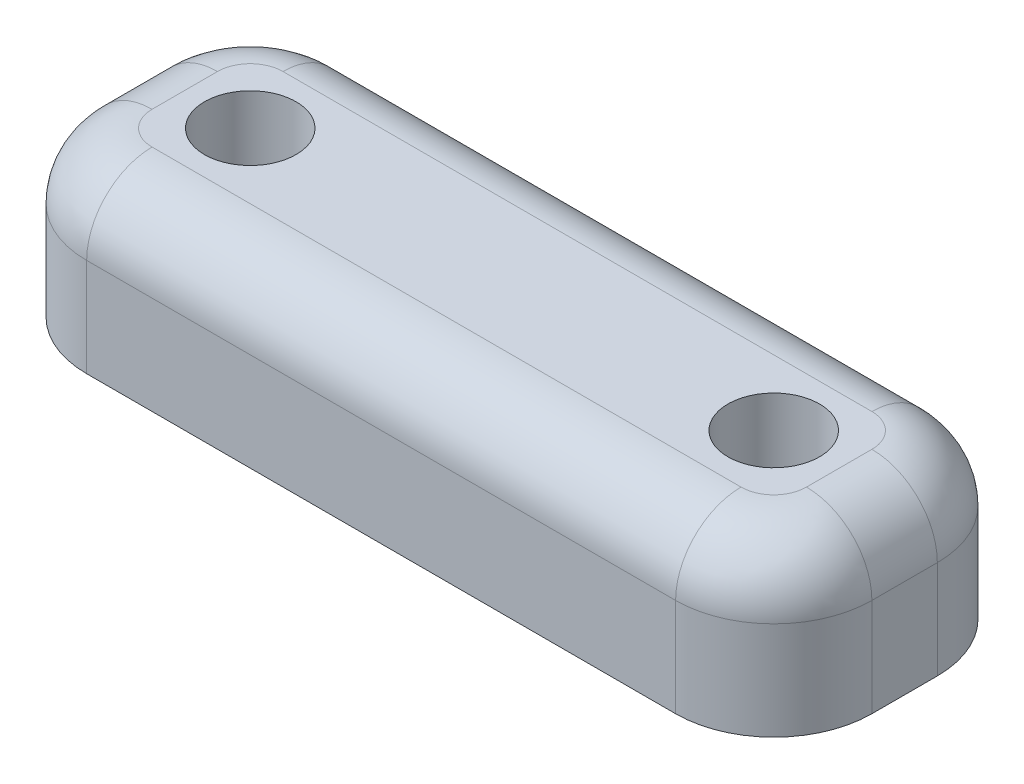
SolidWorks part; units mm, degrees
ref_plane "Front Plane" through (0, 0, 0) normal (0, 0, 1) x (1, 0, 0)
ref_plane "Top Plane" through (0, 0, 0) normal (0, 1, 0) x (1, 0, 0)
ref_plane "Right Plane" through (0, 0, 0) normal (1, 0, 0) x (0, 0, -1)
sketch "Sketch1" plane through (0, 0, 0) normal (0, 1, 0) x (1, 0, 0)
  line L0 (0, 9.7865) -> (0, -14.0594) construction
  line L1 (-12, 2.2477) -> (12, 2.2477)
  line L2 (-12, 2.2477) -> (-12, -5.7523)
  line L3 (-12, -5.7523) -> (12, -5.7523)
  line L4 (12, 2.2477) -> (12, -5.7523)
  line L5 (-8.3778, -1.7523) -> (19.0871, -1.7523) construction
  circle A0 centre (-8, -1.7523) radius 1.4
  circle A1 centre (8, -1.7523) radius 1.4
  dimension "D1" = 2.8
  dimension "D2" = 2.8
  dimension "D3" = 8
  dimension "D4" = 8
  dimension "D5" = 24
  dimension "D6" = 12
  dimension "D7" = 8
  dimension "D8" = 4
extrude "Boss-Extrude1" add sketch "Sketch1" along normal blind 5
fillet "Fillet1" radius 3 4 edges at (12, 2.5, 5.7523) (12, 2.5, -2.2477) (-12, 2.5, 5.7523) (-12, 2.5, -2.2477)
fillet "Fillet2" radius 2 8 edges at (11.1213, 5, -1.369) (12, 5, 1.7523) (11.1213, 5, 4.8737) (-11.1213, 5, 4.8737) (-12, 5, 1.7523) (-11.1213, 5, -1.369) (0, 5, -2.2477) (0, 5, 5.7523)
